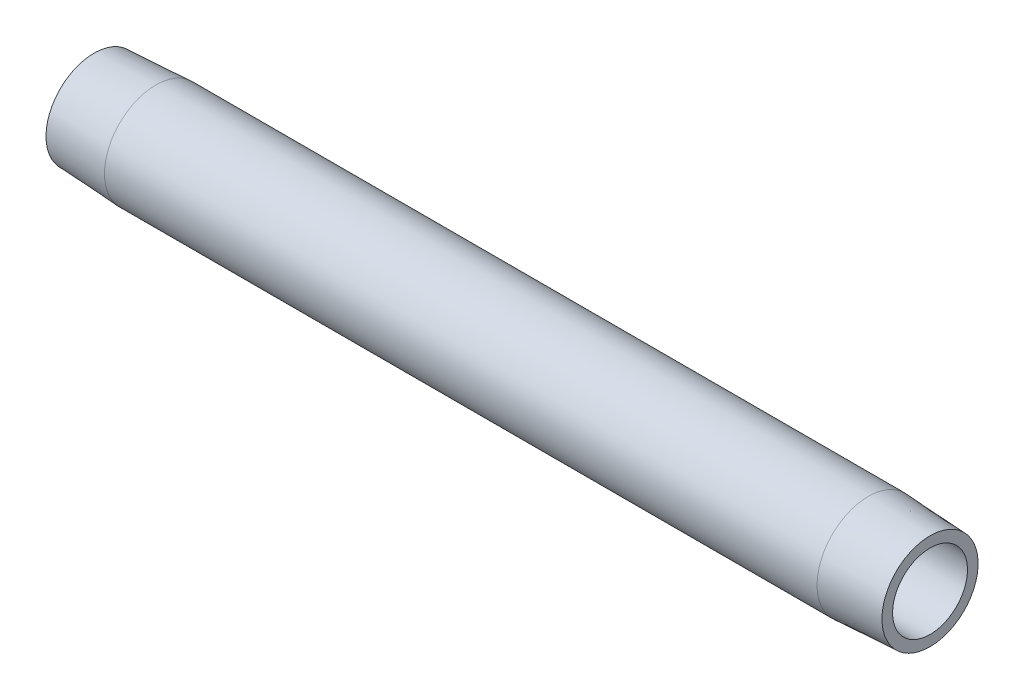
SolidWorks part; units mm, degrees
ref_plane "Front Plane" through (0, 0, 0) normal (0, 0, 1) x (1, 0, 0)
ref_plane "Top Plane" through (0, 0, 0) normal (0, 1, 0) x (1, 0, 0)
ref_plane "Right Plane" through (0, 0, 0) normal (1, 0, 0) x (0, 0, -1)
sketch "Sketch1" plane through (0, 0, 0) normal (0, 0, 1) x (1, 0, 0)
  line L5 (139.7, 6.2611) -> (0, 6.2611)
  line L6 (129.3876, 8.5725) -> (10.3124, 8.5725)
  line L7 (10.3124, 8.5725) -> (0, 8.0321)
  line L8 (139.7, 8.0321) -> (129.3876, 8.5725)
  line L9 (139.7, 6.2611) -> (139.7, 8.0321)
  line L10 (0, 6.2611) -> (0, 8.0321)
  line L11 (0, 0) -> (50000, 0) construction
  line L12 (0, -55) -> (0, 55) construction
  dimension "D1" = 12.5222
  dimension "D2" = 17.145
  dimension "D3" = 3
  dimension "D4" = 3
  dimension "D5" = 139.7
  dimension "D6" = 10.3124
  dimension "D7" = 10.3124
revolve "Revolve1" add sketch "Sketch1" angle 360 about L11
